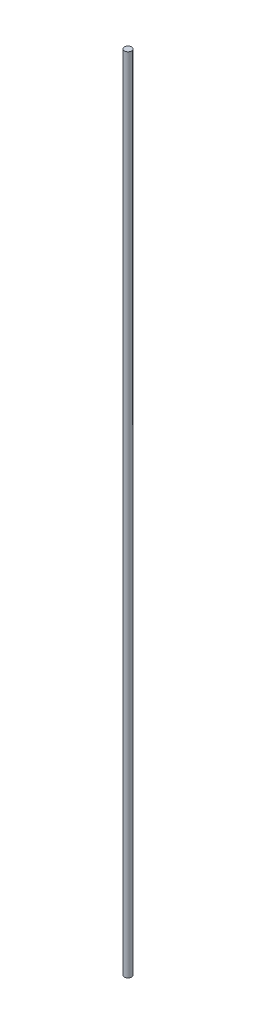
SolidWorks part; units mm, degrees
ref_plane "Front Plane" through (0, 0, 0) normal (0, 0, 1) x (1, 0, 0)
ref_plane "Top Plane" through (0, 0, 0) normal (0, 1, 0) x (1, 0, 0)
ref_plane "Right Plane" through (0, 0, 0) normal (1, 0, 0) x (0, 0, -1)
sketch "Sketch1" plane through (0, 0, 0) normal (0, 1, 0) x (1, 0, 0)
  circle A0 centre (0, 0) radius 4
  dimension "D1" = 8
extrude "Boss-Extrude1" add sketch "Sketch1" along normal blind 900
